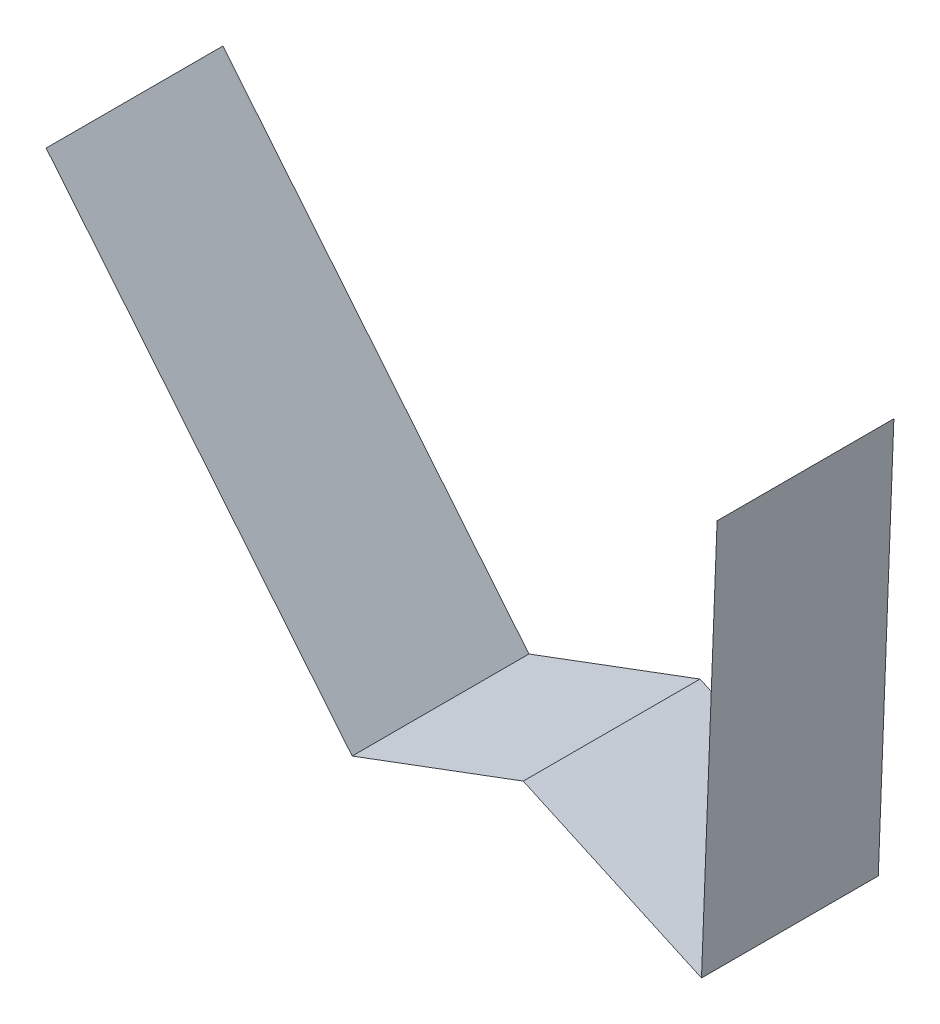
SolidWorks part; units mm, degrees
ref_plane "xy" through (0, 0, 0) normal (0, 0, 1) x (1, 0, 0)
ref_plane "xz" through (0, 0, 0) normal (0, 1, 0) x (1, 0, 0)
ref_plane "yz" through (0, 0, 0) normal (1, 0, 0) x (0, 0, -1)
sketch "Skizze1" plane through (0, 0, 0) normal (0, 0, 1) x (1, 0, 0)
  line L0 (-124.1729, 103.3586) -> (-22.0274, -21.3028)
  line L1 (-22.0274, -21.3028) -> (35.0699, 0)
  line L2 (35.0699, 0) -> (94.5641, -27.1628)
  line L3 (94.5641, -27.1628) -> (99.7713, 107.5952)
surface "Oberfläche-Linear austragen1" sketch "Skizze1" parameters "D1"=59
other "Fläche löschen1" [suppressed]
sketch3d "3D-Skizze1"
  line L0 (-22.0274, -21.3028, 11.5192) -> (-91.6055, 63.6125, 5.35) construction
  line L1 (-22.0274, -21.3028, 11.5192) -> (-1.7411, -13.7341, 15.9961) construction
  line L2 (35.0699, 0, 40.7827) -> (-1.7411, -13.7341, 15.9961) construction
  line L3 (35.0699, 0, 40.7827) -> (54.7882, -9.0026, 50.9438) construction
  line L4 (94.5641, -27.1628, 50.9186) -> (54.7882, -9.0026, 50.9438) construction
  line L5 (98.8578, 83.9554, 55.1735) -> (94.5641, -27.1628, 50.9186) construction
  line L6 (-22.0274, -21.3028, 11.5192) -> (-91.6055, 63.6125, 5.35)
  line L7 (-22.0274, -21.3028, 11.5192) -> (-1.7411, -13.7341, 15.9961)
  line L8 (35.0699, 0, 40.7827) -> (-1.7411, -13.7341, 15.9961)
  line L9 (35.0699, 0, 40.7827) -> (54.7882, -9.0026, 50.9438)
  line L10 (94.5641, -27.1628, 50.9186) -> (54.7882, -9.0026, 50.9438)
  line L11 (98.8578, 83.9554, 55.1735) -> (94.5641, -27.1628, 50.9186)
